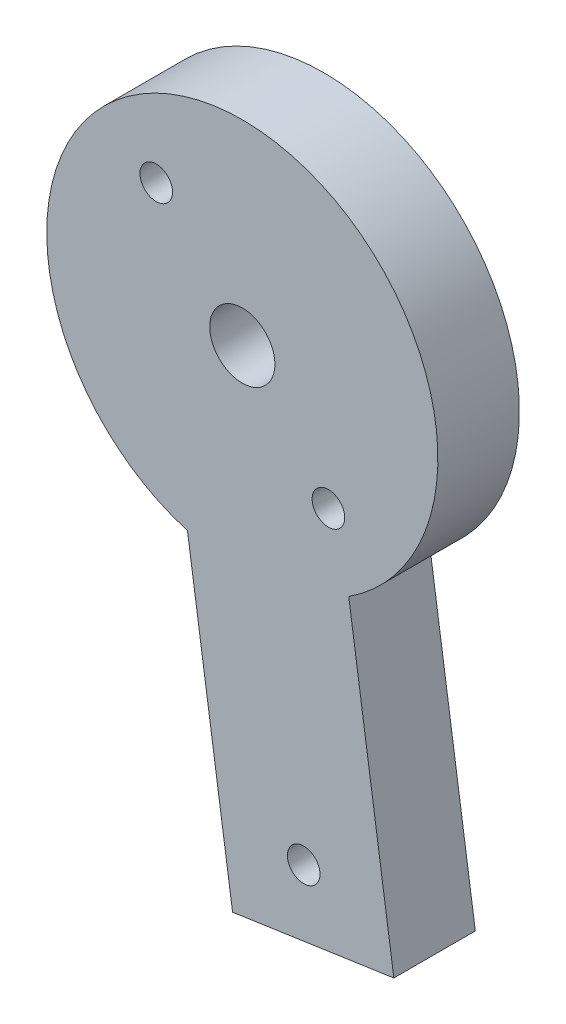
SolidWorks part; units mm, degrees
ref_plane "Front Plane" through (0, 0, 0) normal (0, 0, 1) x (1, 0, 0)
ref_plane "Top Plane" through (0, 0, 0) normal (0, 1, 0) x (1, 0, 0)
ref_plane "Right Plane" through (0, 0, 0) normal (1, 0, 0) x (0, 0, -1)
sketch "Sketch1" plane through (0, 0, 0) normal (0, 0, 1) x (1, 0, 0)
  line L0 (5.0534, 0) -> (10.6366, 0) construction
  line L1 (0, 0) -> (1.4114, -9.6329) construction
  line L3 (-3.3658, -11.5183) -> (-0.5982, -30.4079)
  line L4 (-0.5982, -30.4079) -> (9.2962, -28.9583)
  line L5 (9.2962, -28.9583) -> (6.5286, -10.0686)
  arc A0 (6.5286, -10.0686) -> (-3.3658, -11.5183) centre (0, 0) ccw
  dimension "D1" = 278.335
extrude "Boss-Extrude1" add sketch "Sketch1" along normal blind 5
sketch "Sketch2" plane through (0, 0, 5) normal (0, 0, 1) x (1, 0, 0)
  line L0 (0, 0) -> (4.349, -29.6831) construction
  line L1 (-0.5982, -30.4079) -> (9.2962, -28.9583) construction
  circle A0 centre (0, 0) radius 2
  circle A1 centre (3.7669, -25.7101) radius 1
  dimension "D1" = 25.9846
extrude "Cut-Extrude1" cut sketch "Sketch2" against normal blind 5
sketch "Sketch3" plane through (0, 0, 5) normal (0, 0, 1) x (1, 0, 0)
  line L0 (0, 0) -> (8.6781, 0) construction
  line L1 (0, 0) -> (-5.5835, 6.3514) construction
  line L2 (0, 0) -> (5.7901, -6.5865) construction
  circle A0 centre (-5.2819, 6.0084) radius 1
  circle A1 centre (5.2819, -6.0084) radius 1
  circle A2 centre (0, 0) radius 2 construction
  dimension "D3" = 8
  dimension "D4" = 8
  dimension "D1" = 131.318
  dimension "D2" = 180
extrude "Cut-Extrude2" cut sketch "Sketch3" against normal blind 5
sketch "Sketch4" plane through (0, 0, 5) normal (0, 0, 1) x (1, 0, 0)
  line L0 (0, 0) -> (10.4613, 0)
